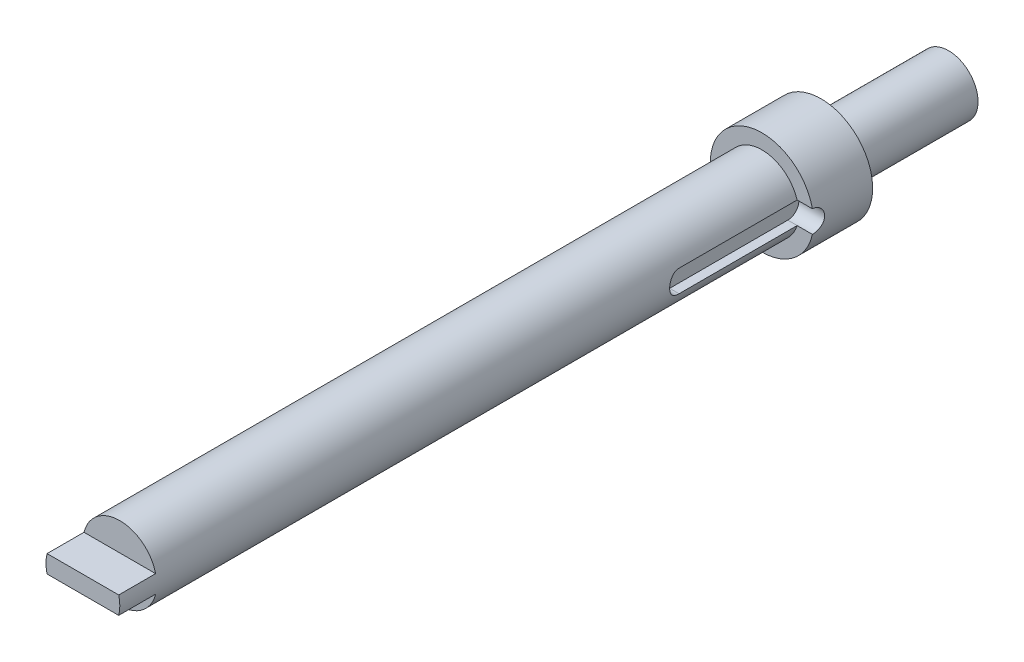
SolidWorks part; units mm, degrees
ref_plane "Front Plane" through (0, 0, 0) normal (0, 0, 1) x (1, 0, 0)
ref_plane "Top Plane" through (0, 0, 0) normal (0, 1, 0) x (1, 0, 0)
ref_plane "Right Plane" through (0, 0, 0) normal (1, 0, 0) x (0, 0, -1)
sketch "Sketch3" plane through (0, 0, 0) normal (0, 0, 1) x (1, 0, 0)
  circle A0 centre (0, 0) radius 7.9375
  dimension "D1" = 15.875
extrude "Boss-Extrude1" add sketch "Sketch3" along normal blind 138.1125
sketch "Sketch5" plane through (0, 0, 0) normal (0, 0, -1) x (-1, 0, 0)
  circle A0 centre (0, 0) radius 11.1125
  dimension "D1" = 22.225
extrude "Boss-Extrude2" add sketch "Sketch5" along normal blind 12.7
sketch "Sketch6" plane through (0, 0, -12.7) normal (0, 0, -1) x (-1, 0, 0)
  circle A0 centre (0, 0) radius 11.1125
  dimension "D1" = 22.225
ref_plane "Plane2" through (7.9375, 0, 0) normal (1, 0, 0) x (0, 0, -1)
sketch "Sketch8" plane through (7.9375, 0, 0) normal (1, 0, 0) x (0, 0, -1)
  line L0 (-25.4, 0) -> (0, 0) construction
  line L1 (-25.4, 2.3813) -> (0, 2.3813)
  line L2 (-25.4, -2.3813) -> (0, -2.3813)
  line L3 (0, 11.1125) -> (0, -11.1125) construction
  arc A0 (-25.4, 2.3813) -> (-25.4, -2.3813) centre (-25.4, 0) ccw
  arc A1 (0, -2.3813) -> (0, 2.3813) centre (0, 0) ccw
  point P3 (-12.7, 0)
  dimension "D1" = 0
  dimension "D2" = 25.4
  dimension "D3" = 4.7625
extrude "Cut-Extrude2" cut sketch "Sketch8" against normal blind 2.3813 and the other way through all
sketch "Sketch9" plane through (0, 0, -12.7) normal (0, 0, -1) x (-1, 0, 0)
  circle A0 centre (0, 0) radius 6.35
  dimension "D1" = 12.7
extrude "Boss-Extrude3" add sketch "Sketch9" along normal blind 27.432
sketch "Sketch10" plane through (0, 0, 138.1125) normal (0, 0, 1) x (1, 0, 0)
  line L0 (-7.7055, 1.905) -> (7.7055, 1.905)
  line L1 (-7.7055, -1.905) -> (7.7055, -1.905)
  line L2 (-7.7055, -1.905) -> (7.7055, 1.905) construction
  line L3 (-7.7055, 1.905) -> (7.7055, -1.905) construction
  circle A0 centre (0, 0) radius 7.9375 construction
  arc A1 (-7.7055, -1.905) -> (-7.7055, 1.905) centre (0, 0) cw
  arc A2 (7.7055, 1.905) -> (7.7055, -1.905) centre (0, 0) cw
  point P7 (0, 0)
  point P10 (0, 0)
  point P11 (0, 0)
  point P12 (0, 0)
  dimension "D3" = 3.81
extrude "Boss-Extrude4" add sketch "Sketch10" along normal blind 7.9375
